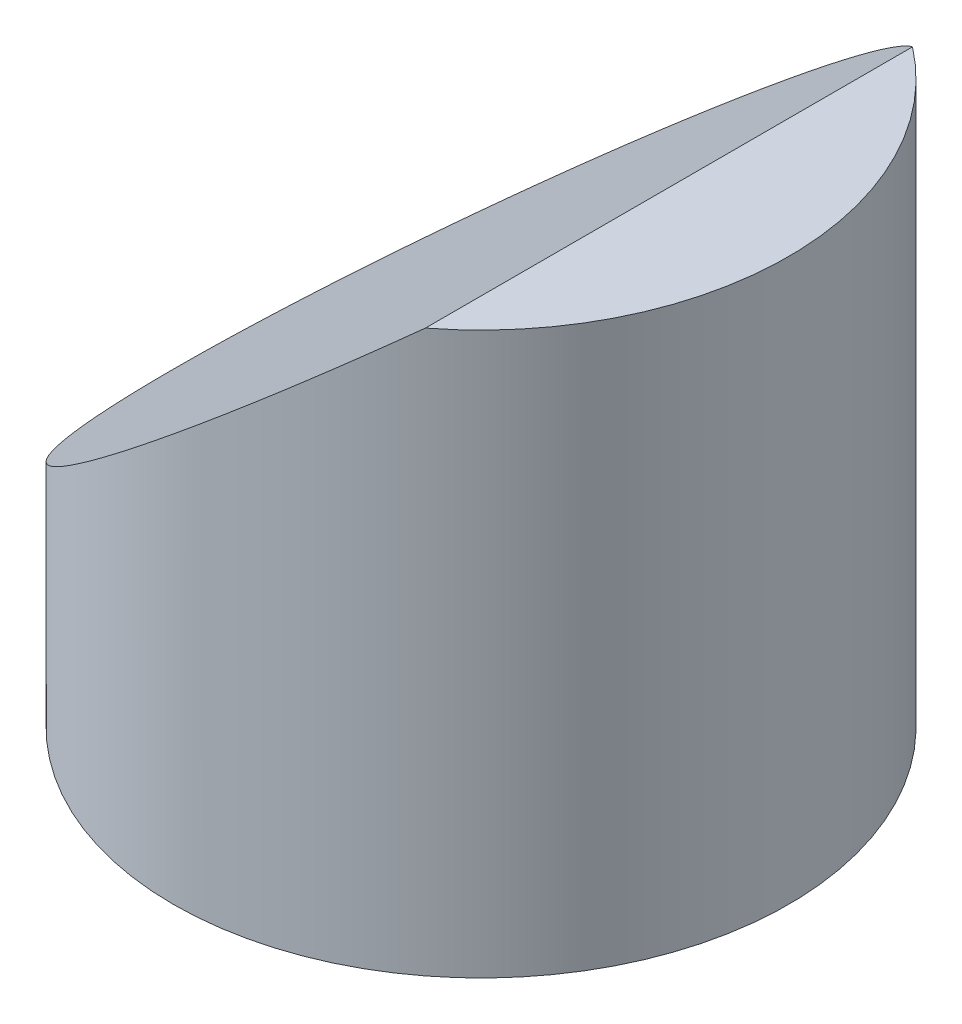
SolidWorks part; units mm, degrees
ref_plane "前视" through (0, 0, 0) normal (0, 0, 1) x (1, 0, 0)
ref_plane "上视" through (0, 0, 0) normal (0, 1, 0) x (1, 0, 0)
ref_plane "右视" through (0, 0, 0) normal (1, 0, 0) x (0, 0, -1)
sketch "草图1" plane through (0, 0, 0) normal (0, 1, 0) x (1, 0, 0)
  circle A0 centre (0, 0) radius 43.8592
extrude "拉伸1" add sketch "草图1" along normal blind 80
sketch "草图2" plane through (0, 0, 0) normal (0, 0, 1) x (1, 0, 0)
  line L0 (32.0271, 84.2752) -> (-49.5716, 17.5728)
extrude "切除-拉伸1" cut sketch "草图2" against normal through all and the other way through all flip side to cut
